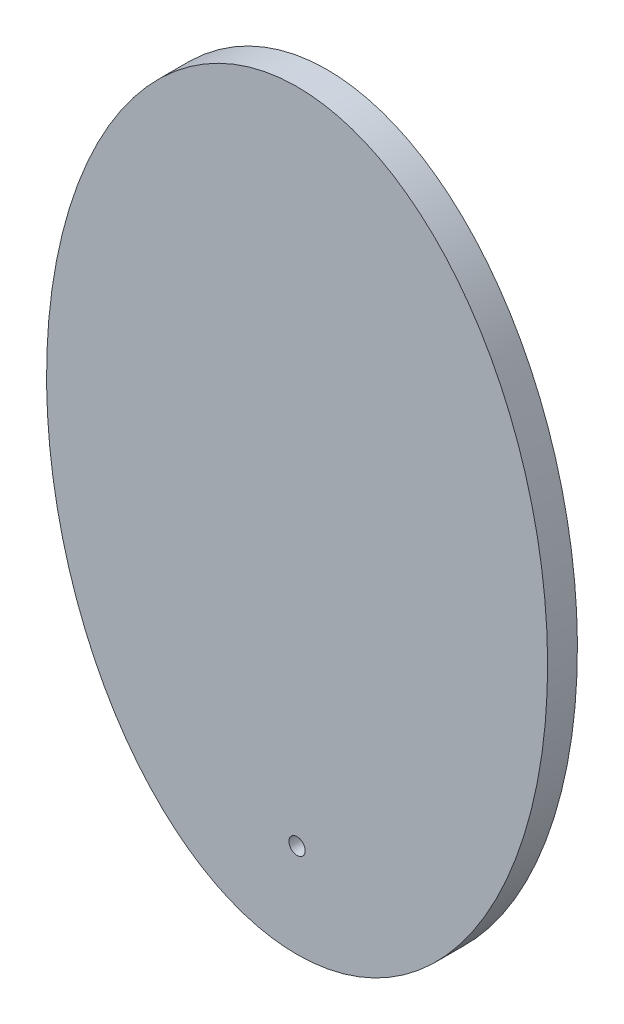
SolidWorks part; units mm, degrees
ref_plane "Front Plane" through (0, 0, 0) normal (0, 0, 1) x (1, 0, 0)
ref_plane "Top Plane" through (0, 0, 0) normal (0, 1, 0) x (1, 0, 0)
ref_plane "Right Plane" through (0, 0, 0) normal (1, 0, 0) x (0, 0, -1)
sketch "Sketch1" plane through (0, 0, 0) normal (0, 0, 1) x (1, 0, 0)
  ellipse E0 centre (0, 0) end of major axis (0, -60) minor radius 40 construction
  ellipse E1 centre (0, 0) end of major axis (0, -60) minor radius 40
extrude "3/16in cast clear acrylic" add sketch "Sketch1" against normal blind 4.7625
sketch "Sketch2" plane through (0, 0, -4.7625) normal (0, 0, -1) x (1, 0, 0)
  line L0 (31.955, 30) -> (26.8809, -40) construction
  circle A0 centre (26.8809, -40) radius 1.65
  circle A1 centre (-26.8799, -40) radius 1.65
  circle A2 centre (-31.955, 30) radius 1.65
  circle A3 centre (31.955, 30) radius 1.65
  spline S0 degree 3 number of poles 141 (0, -57.5) -> (0, -57.5) construction
  dimension "D1" = 3.3
extrude "laser rastered M2 threaded insert pocket" cut sketch "Sketch2" against normal blind 3
sketch "Sketch3" plane through (0, 0, -4.7625) normal (0, 0, -1) x (1, 0, 0)
  circle A0 centre (26.8809, -40) radius 2.25
  circle A1 centre (-26.8799, -40) radius 2.25
  circle A2 centre (-31.955, 30) radius 2.25
  circle A3 centre (31.955, 30) radius 2.25
  dimension "D1" = 4.5
extrude "laser rastered plastic overflow pocket" cut sketch "Sketch3" against normal blind 0.5
sketch "Sketch4" plane through (0, 0, -4.7625) normal (0, 0, -1) x (1, 0, 0)
  line L0 (0, -62.5) -> (0, 62.5) construction
  circle A0 centre (0, 45) radius 1.3
  dimension "D2" = 2.6
  dimension "D1" = 45
extrude "laser cut hole, tapped, M3" cut sketch "Sketch4" against normal through all
sketch "Sketch5" plane through (0, 0, 0) normal (0, 0, 1) x (1, 0, 0)
  line L1 (45, -65) -> (-45, -65)
  line L2 (45, -65) -> (45, 65)
  line L3 (45, 65) -> (-45, 65)
  line L4 (-45, -65) -> (-45, 65)
  line L5 (45, -65) -> (-45, 65) construction
  line L6 (45, 65) -> (-45, -65) construction
  ellipse E0 centre (0, 0) end of major axis (0, -60) minor radius 40 construction
  ellipse E1 centre (0, 0) end of major axis (0, -60) minor radius 40
  point P0 (0, 0)
  dimension "D1" = 5
  dimension "D2" = 5
  dimension "D3" = 130
  dimension "D4" = 90
equation "\"D1@3/16in cast clear acrylic\" =  ( 3in / 16 ) "
